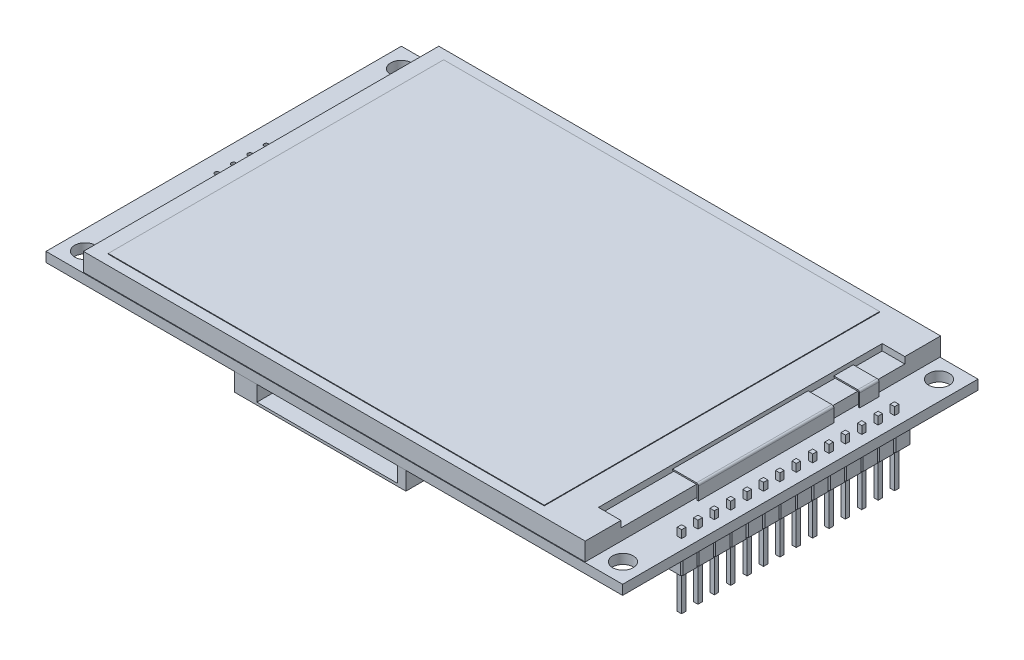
SolidWorks part; units mm, degrees
ref_plane "Ebene vorne" through (0, 0, 0) normal (0, 0, 1) x (1, 0, 0)
ref_plane "Ebene oben" through (0, 0, 0) normal (0, 1, 0) x (1, 0, 0)
ref_plane "Ebene rechts" through (0, 0, 0) normal (1, 0, 0) x (0, 0, -1)
sketch "Skizze1" plane through (0, 0, 0) normal (0, 1, 0) x (1, 0, 0)
  line L1 (-33.8, -26) -> (33.8, -26)
  line L2 (-33.8, -26) -> (-33.8, 26)
  line L3 (-33.8, 26) -> (33.8, 26)
  line L4 (33.8, -26) -> (33.8, 26)
  line L5 (-33.8, -26) -> (33.8, 26) construction
  line L6 (-33.8, 26) -> (33.8, -26) construction
  point P0 (0, 0)
  dimension "D1" = 52
  dimension "D2" = 67.6
extrude "Aufsatz-Linear austragen1" add sketch "Skizze1" along normal blind 0.1
sketch "Skizze2" plane through (0, 0, 0) normal (0, -1, 0) x (1, 0, 0)
  line L0 (55, 0) -> (-55, 0) construction
  line L1 (-36.1, -27.55) -> (41.7, -27.55)
  line L2 (-36.1, -27.55) -> (-36.1, 27.55)
  line L3 (-36.1, 27.55) -> (41.7, 27.55)
  line L4 (41.7, -27.55) -> (41.7, 27.55)
  line L6 (33.8, 26) -> (33.8, -26) construction
  point P4 (41.7, 0)
  dimension "D1" = 55.1
  dimension "D2" = 7.9
  dimension "D3" = 77.8
extrude "Aufsatz-Linear austragen2" add sketch "Skizze2" along normal blind 2.8 separate body
sketch "Skizze3" plane through (0, -2.8, 0) normal (0, -1, 0) x (1, 0, 0)
  line L0 (0.055, 0) -> (-0.055, 0) construction
  line L1 (-41.9, 27.55) -> (47.5, 27.55)
  line L2 (-41.9, 27.55) -> (-41.9, -27.55)
  line L3 (-41.9, -27.55) -> (47.5, -27.55)
  line L4 (47.5, 27.55) -> (47.5, -27.55)
  line L5 (41.7, 27.55) -> (-36.1, 27.55) construction
  line L6 (33.8, 26) -> (33.8, -26) construction
  point P4 (47.5, 0)
  dimension "D1" = 13.7
  dimension "D2" = 89.4
extrude "Aufsatz-Linear austragen3" add sketch "Skizze3" along normal blind 1.5 from offset 0.1 separate body
sketch "Skizze4" plane through (0, -2.9, 0) normal (0, 1, 0) x (1, 0, 0)
  line L0 (-1.595, 0) -> (1.595, 0) construction
  line L3 (47.5, 27.55) -> (47.5, -27.55) construction
  circle A0 centre (44.5, 24.5) radius 1.6
  circle A1 centre (44.5, -24.5) radius 1.6
  circle A2 centre (-38.9, -24.5) radius 1.6
  circle A3 centre (-38.9, 24.5) radius 1.6
  point P10 (0, 0)
  point P11 (0, 0)
  point P14 (0, 0)
  point P15 (0, 0)
extrude "Schnitt-Linear austragen1" cut sketch "Skizze4" against normal through all
sketch "Skizze6" plane through (0, -4.4, 0) normal (0, -1, 0) x (1, 0, 0)
  line L0 (46.7, 17.81) -> (46.9, 17.61)
  line L1 (44.5, 17.81) -> (46.7, 17.81)
  line L2 (44.3, 17.61) -> (44.3, 15.41)
  line L3 (44.5, 15.21) -> (46.7, 15.21)
  line L4 (46.9, 17.61) -> (46.9, 15.41)
  line L5 (44.3, 17.81) -> (46.9, 15.21) construction
  line L6 (44.3, 15.21) -> (46.9, 17.81) construction
  line L7 (44.3, 17.61) -> (44.5, 17.81)
  line L8 (44.3, 15.41) -> (44.5, 15.21)
  line L9 (46.9, 15.41) -> (46.7, 15.21)
  line L10 (1.595, 0) -> (-1.595, 0) construction
  line L11 (47.5, -27.55) -> (47.5, 27.55) construction
  point P0 (45.6, 16.51)
  dimension "D1" = 2.6
  dimension "D2" = 16.51
  dimension "D7" = 1.9
extrude "Aufsatz-Linear austragen4" add sketch "Skizze6" along normal blind 2.6
pattern_linear "Lineares Muster1" count 14 spacing 2.54 along (0, 0, -1) of "Aufsatz-Linear austragen4"
sketch "Skizze7" plane through (0, -7, 0) normal (0, -1, 0) x (1, 0, 0)
  line L0 (46.8, 17.71) -> (44.4, 15.31) construction
  line L1 (46.9, 17.61) -> (46.7, 17.81) construction
  line L3 (44.4, 17.71) -> (46.815, 15.325) construction
  line L4 (44.5, 17.81) -> (44.3, 17.61) construction
  line L5 (46.73, 15.24) -> (46.9, 15.41) construction
  line L7 (45.265, 16.175) -> (45.935, 16.175)
  line L8 (45.265, 16.175) -> (45.265, 16.845)
  line L9 (45.265, 16.845) -> (45.935, 16.845)
  line L10 (45.935, 16.175) -> (45.935, 16.845)
  line L11 (45.265, 16.175) -> (45.935, 16.845) construction
  line L12 (45.265, 16.845) -> (45.935, 16.175) construction
  line L13 (44.3, 15.41) -> (44.47, 15.24) construction
  point P4 (0, 0)
  point P12 (45.6, 16.51)
  point P17 (0, 0)
  dimension "D1" = 0.67
extrude "Aufsatz-Linear austragen5" add sketch "Skizze7" along normal blind 6 and the other way blind 5.3 separate body
pattern_linear "Lineares Muster3" count 14 spacing 2.54 along (0, 0, -1) of "Aufsatz-Linear austragen5"
sketch "Skizze8" plane through (0, -4.4, 0) normal (0, -1, 0) x (1, 0, 0)
  line L0 (1.595, 0) -> (-1.595, 0) construction
  line L5 (-41.9, 27.55) -> (-41.9, -27.55) construction
  circle A0 centre (-39.1, 3.81) radius 0.35
  dimension "D1" = 0.7
  dimension "D3" = 2.8
  dimension "D2" = 3.81
extrude "Schnitt-Linear austragen2" cut sketch "Skizze8" against normal through all
pattern_linear "Lineares Muster2" count 4 spacing 2.54 along (0, 0, -1) of "Schnitt-Linear austragen2"
sketch "Skizze9" plane through (0, -4.4, 0) normal (0, -1, 0) x (1, 0, 0)
  line L0 (13.9, 27.55) -> (13.9, 9.35)
  line L1 (47.5, 27.55) -> (-41.9, 27.55) construction
  line L2 (13.9, 9.35) -> (-10.5, 9.35)
  line L3 (-10.5, 9.35) -> (-10.5, 15.05)
  line L4 (-10.5, 15.05) -> (-12.7, 17.55)
  line L5 (-12.7, 17.55) -> (-12.7, 27.55)
  line L6 (-12.7, 27.55) -> (13.9, 27.55)
  line L7 (47.5, -27.55) -> (47.5, 27.55) construction
  dimension "D1" = 26.6
  dimension "D2" = 24.4
  dimension "D3" = 18.2
  dimension "D4" = 33.6
  dimension "D5" = 5.7
  dimension "D6" = 10
extrude "Aufsatz-Linear austragen6" add sketch "Skizze9" along normal blind 2.8 separate body
sketch "Skizze10" plane through (0, -4.4, 0) normal (0, -1, 0) x (1, 0, 0)
  line L0 (13.9, 27.55) -> (-12.7, 27.55) construction
  line L1 (12.6, 27.55) -> (-9.2, 27.55)
  line L2 (12.6, 27.55) -> (12.6, 13.55)
  line L3 (12.6, 13.55) -> (-9.2, 13.55)
  line L4 (-9.2, 27.55) -> (-9.2, 13.55)
  line L6 (-10.5, 15.05) -> (-10.5, 9.35) construction
  line L7 (13.9, 9.35) -> (13.9, 27.55) construction
  dimension "D1" = 14
  dimension "D2" = 1.3
  dimension "D3" = 1.3
extrude "Schnitt-Linear austragen3" cut sketch "Skizze10" along normal blind 2.4
sketch "Skizze11" plane through (0, -4.4, 0) normal (0, -1, 0) x (1, 0, 0)
  line L0 (47.5, 27.55) -> (-41.9, 27.55) construction
  line L1 (29.25, 5.35) -> (27.95, 5.35)
  line L2 (29.25, 5.35) -> (29.25, 2.35)
  line L3 (29.25, 2.35) -> (27.95, 2.35)
  line L4 (27.95, 5.35) -> (27.95, 2.35)
  line L5 (30, -2.2) -> (27, -2.2)
  line L6 (30, -2.2) -> (30, -3.5)
  line L7 (30, -3.5) -> (27, -3.5)
  line L8 (27, -2.2) -> (27, -3.5)
  line L9 (47.5, -27.55) -> (47.5, 27.55) construction
  point P8 (29.25, 3.85)
  point P11 (28.6, 2.35)
  point P14 (30, -2.85)
  point P15 (28.5, -3.5)
  dimension "D1" = 1.3
  dimension "D2" = 3
  dimension "D3" = 23.7
  dimension "D4" = 18.9
  dimension "D5" = 30.4
  dimension "D6" = 19
extrude "Aufsatz-Linear austragen7" add sketch "Skizze11" along normal blind 1 separate body
sketch "Skizze12" plane through (0, -4.4, 0) normal (0, -1, 0) x (1, 0, 0)
  line L0 (47.5, 27.55) -> (-41.9, 27.55) construction
  line L1 (32.45, 4.85) -> (31.55, 4.85)
  line L2 (32.45, 4.85) -> (32.45, 2.85)
  line L3 (32.45, 2.85) -> (31.55, 2.85)
  line L4 (31.55, 4.85) -> (31.55, 2.85)
  line L5 (25.65, 4.85) -> (24.75, 4.85)
  line L6 (25.65, 4.85) -> (25.65, 2.85)
  line L7 (25.65, 2.85) -> (24.75, 2.85)
  line L8 (24.75, 4.85) -> (24.75, 2.85)
  line L9 (25.65, -1.85) -> (24.75, -1.85)
  line L10 (25.65, -1.85) -> (25.65, -3.85)
  line L11 (25.65, -3.85) -> (24.75, -3.85)
  line L12 (24.75, -1.85) -> (24.75, -3.85)
  line L13 (32.45, -12.15) -> (31.55, -12.15)
  line L14 (32.45, -12.15) -> (32.45, -14.15)
  line L15 (32.45, -14.15) -> (31.55, -14.15)
  line L16 (31.55, -12.15) -> (31.55, -14.15)
  line L17 (30.85, -12.15) -> (29.95, -12.15)
  line L18 (30.85, -12.15) -> (30.85, -14.15)
  line L19 (30.85, -14.15) -> (29.95, -14.15)
  line L20 (29.95, -12.15) -> (29.95, -14.15)
  line L21 (3.9, -1.55) -> (3, -1.55)
  line L22 (3.9, -1.55) -> (3.9, -3.55)
  line L23 (3.9, -3.55) -> (3, -3.55)
  line L24 (3, -1.55) -> (3, -3.55)
  line L25 (1.6, -1.55) -> (0.7, -1.55)
  line L26 (1.6, -1.55) -> (1.6, -3.55)
  line L27 (1.6, -3.55) -> (0.7, -3.55)
  line L28 (0.7, -1.55) -> (0.7, -3.55)
  line L29 (-0.7, -1.55) -> (-1.6, -1.55)
  line L30 (-0.7, -1.55) -> (-0.7, -3.55)
  line L31 (-0.7, -3.55) -> (-1.6, -3.55)
  line L32 (-1.6, -1.55) -> (-1.6, -3.55)
  line L33 (47.5, -27.55) -> (47.5, 27.55) construction
  line L34 (34.0778, 3.85) -> (28.8209, 3.85) construction
  line L35 (29.25, 2.35) -> (29.25, 5.35) construction
  point P32 (3.45, -3.55)
  point P33 (1.15, -3.55)
  point P34 (-1.15, -3.55)
  point P35 (3.9, -2.55)
  point P40 (32, -14.15)
  point P41 (30.4, -14.15)
  point P42 (32.45, 3.85)
  point P43 (32.45, -13.15)
  point P48 (29.25, 3.85)
  point P49 (31.55, 3.85)
  point P50 (32, 2.85)
  point P51 (25.2, 2.85)
  point P55 (25.65, 3.85)
  point P56 (25.65, -2.85)
  dimension "D1" = 2
  dimension "D2" = 0.9
  dimension "D3" = 2.3
  dimension "D4" = 2.3
  dimension "D5" = 30.1
  dimension "D6" = 46.35
  dimension "D7" = 1.6
  dimension "D8" = 17
  dimension "D9" = 6.8
  dimension "D11" = 6.7
extrude "Aufsatz-Linear austragen8" add sketch "Skizze12" along normal blind 0.6 separate body
sketch "Skizze13" plane through (0, 0, 0) normal (0, 1, 0) x (1, 0, 0)
  line L0 (41.7, 27.55) -> (41.7, -27.55) construction
  line L1 (41.7, -22) -> (38.2, -22)
  line L2 (41.7, -22) -> (41.7, 22)
  line L3 (41.7, 22) -> (38.2, 22)
  line L4 (38.2, -22) -> (38.2, 22)
  line L5 (-7.205, 0) -> (7.205, 0) construction
  point P6 (41.7, 0)
  dimension "D1" = 44
  dimension "D2" = 3.5
extrude "Schnitt-Linear austragen4" cut sketch "Skizze13" against normal blind 1
sketch "Skizze14" plane through (0, 0, 0) normal (0, 0, 1) x (1, 0, 0)
  line L0 (38.2, -0.6) -> (38.2, -0.8)
  line L1 (38.2, -0.8) -> (41.9, -0.8)
  line L2 (42, -0.9) -> (42, -2.9)
  line L3 (42, -2.9) -> (42.2, -2.9)
  line L4 (42.2, -2.9) -> (42.2, -0.9)
  line L5 (41.9, -0.6) -> (38.2, -0.6)
  line L6 (38.2, -1) -> (38.2, 0) construction
  line L7 (41.7, -2.8) -> (41.7, 0) construction
  line L8 (41.7, -1) -> (38.2, -1) construction
  line L9 (47.5, -2.9) -> (-41.9, -2.9) construction
  arc A0 (41.9, -0.8) -> (42, -0.9) centre (41.9, -0.9) cw
  arc A1 (42.2, -0.9) -> (41.9, -0.6) centre (41.9, -0.9) ccw
  dimension "D1" = 0.2
  dimension "D4" = 0.1
  dimension "D2" = 0.5
  dimension "D3" = 0.2
extrude "Aufsatz-Linear austragen9" add sketch "Skizze14" along normal mid plane 21 separate body
sketch "Skizze15" plane through (0, 0, 0) normal (0, 0, 1) x (1, 0, 0)
  line L6 (38.2, -0.8) -> (41.9, -0.8)
  line L7 (38.2, -0.6) -> (38.2, -0.8)
  line L8 (41.9, -0.6) -> (38.2, -0.6)
  line L9 (42.2, -2.9) -> (42.2, -0.9)
  line L10 (38.2, -0.6) -> (38.2, -0.8)
  line L11 (42, -0.9) -> (42, -2.9)
  line L12 (38.2, -0.8) -> (41.9, -0.8)
  line L14 (41.9, -0.6) -> (38.2, -0.6)
  line L15 (42.2, -2.9) -> (42.2, -0.9)
  line L17 (42, -0.9) -> (42, -2.9)
  line L18 (42, -2.9) -> (42.2, -2.9)
  line L19 (42, -2.9) -> (42.2, -2.9)
  arc A2 (42.2, -0.9) -> (41.9, -0.6) centre (41.9, -0.9) ccw
  arc A3 (42, -0.9) -> (41.9, -0.8) centre (41.9, -0.9) ccw
  arc A4 (42.2, -0.9) -> (41.9, -0.6) centre (41.9, -0.9) ccw
  arc A5 (42, -0.9) -> (41.9, -0.8) centre (41.9, -0.9) ccw
  dimension "D1" = 0
extrude "Aufsatz-Linear austragen10" add sketch "Skizze15" against normal blind 3 from offset 14.5 separate body
equation "\"D3@Skizze4\"=\"D2@Skizze4\"/2"
